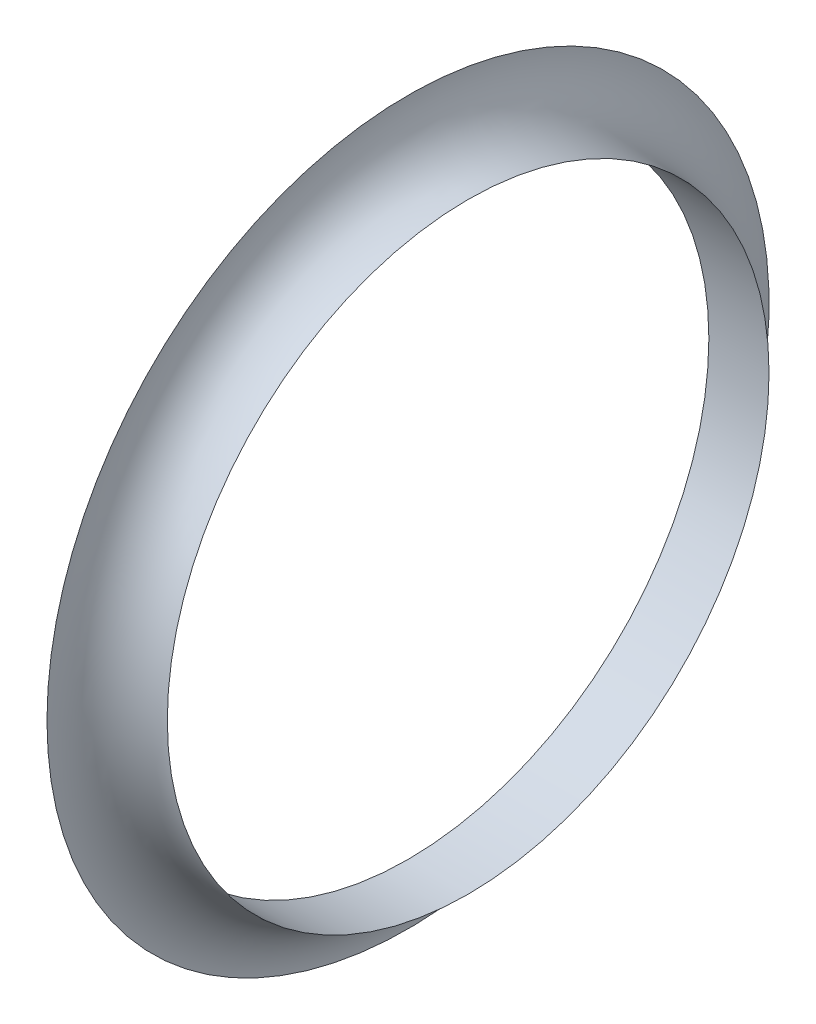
SolidWorks part; units mm, degrees
ref_plane "Face" through (0, 0, 0) normal (0, 0, 1) x (1, 0, 0)
ref_plane "Dessus" through (0, 0, 0) normal (0, 1, 0) x (1, 0, 0)
ref_plane "Droite" through (0, 0, 0) normal (1, 0, 0) x (0, 0, -1)
sketch "Esquisse1" plane through (0, 0, 0) normal (0, 0, 1) x (1, 0, 0)
  line L0 (0, 0) -> (79.1982, 0) construction
  line L1 (-5, 30) -> (-5, 25)
  line L2 (-5, 25) -> (0, 25)
  arc A0 (-5, 30) -> (0, 25) centre (0, 30) ccw
  dimension "D1" = 10
  dimension "D2" = 25
revolve "Révolution1" add sketch "Esquisse1" angle 360 about L0
